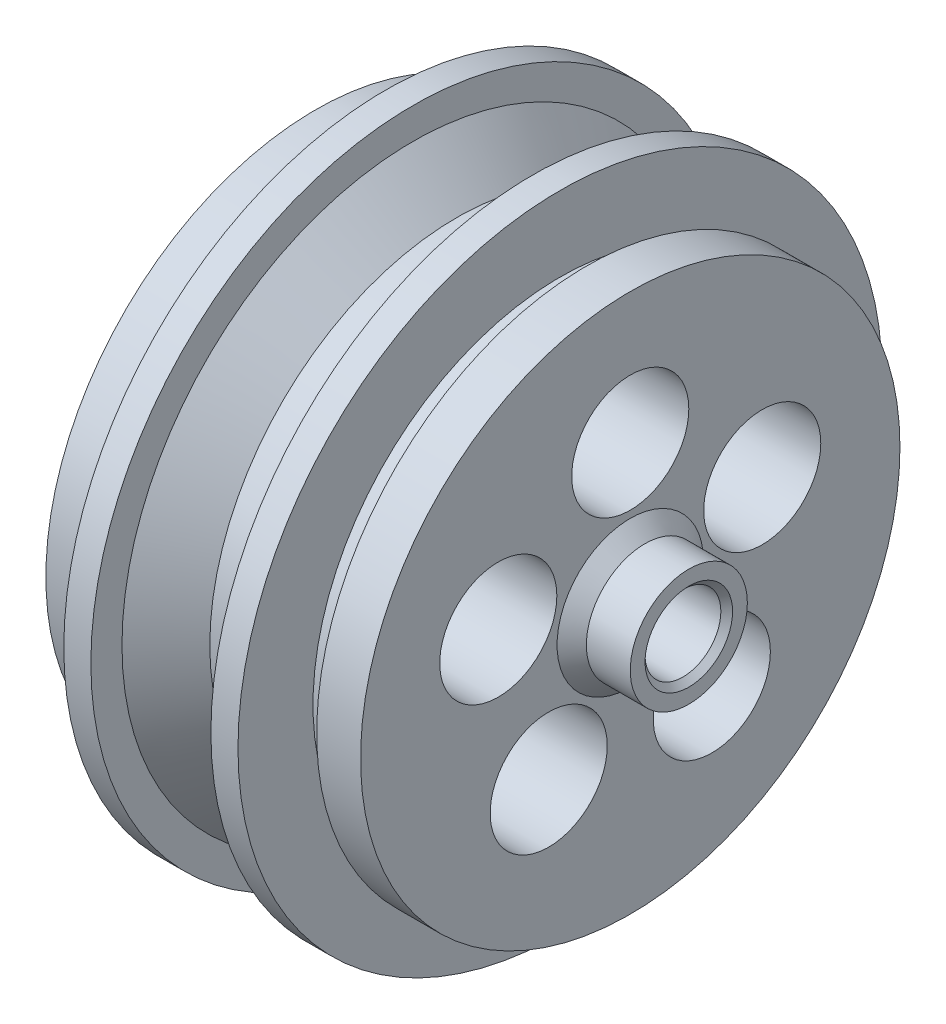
SolidWorks part; units mm, degrees
ref_plane "Front Plane" through (0, 0, 0) normal (0, 0, 1) x (1, 0, 0)
ref_plane "Top Plane" through (0, 0, 0) normal (0, 1, 0) x (1, 0, 0)
ref_plane "Right Plane" through (0, 0, 0) normal (1, 0, 0) x (0, 0, -1)
sketch "Sketch1" plane through (0, 0, 0) normal (1, 0, 0) x (0, 0, -1)
  circle A0 centre (0, 0) radius 16.875
  dimension "D1" = 33.75
extrude "Boss-Extrude1" add sketch "Sketch1" along normal blind 8.2
sketch "Sketch2" plane through (8.2, 0, 0) normal (1, 0, 0) x (0, 0, -1)
  circle A0 centre (0, 0) radius 22
  dimension "D1" = 44
extrude "Boss-Extrude2" add sketch "Sketch2" along normal blind 1.85
sketch "Sketch3" plane through (10.05, 0, 0) normal (1, 0, 0) x (0, 0, -1)
  circle A0 centre (0, 0) radius 16.875
  dimension "D1" = 33.75
extrude "Boss-Extrude3" add sketch "Sketch3" along normal blind 1.8
sketch "Sketch4" plane through (11.85, 0, 0) normal (1, 0, 0) x (0, 0, -1)
  circle A0 centre (0, 0) radius 18.425
  dimension "D1" = 36.85
extrude "Boss-Extrude4" add sketch "Sketch4" along normal blind 3
ref_plane "Plane1" through (4.1, 0, 0) normal (-1, 0, 0) x (0, 0, 1)
mirror "Mirror1" about plane through (4.1, 0, 0) normal (-1, 0, 0) of "Boss-Extrude3", "Boss-Extrude4", "Boss-Extrude2"
sketch "Sketch5" plane through (14.85, 0, 0) normal (1, 0, 0) x (0, 0, -1)
  circle A0 centre (0, 0) radius 2.59
  dimension "D1" = 5.18
extrude "Cut-Extrude1" cut sketch "Sketch5" against normal through all both and the other way through all
sketch "Sketch6" plane through (14.85, 0, 0) normal (1, 0, 0) x (0, 0, -1)
  line L0 (0, 0) -> (0, 9.4798) construction
  circle A0 centre (0, 9.4798) radius 4
  dimension "D1" = 8
extrude "Cut-Extrude2" cut sketch "Sketch6" against normal through all both and the other way through all
pattern_circular "CirPattern1" count 5 over 360 about axis through (0, 0, 0) along (1, 0, 0) of "Cut-Extrude2"
chamfer "Chamfer1" distance 3 angle 45 2 edges at (8.2, 0, -16.875) (0, 0, -16.875)
sketch "Sketch7" plane through (14.85, 0, 0) normal (1, 0, 0) x (0, 0, -1)
  circle A0 centre (0, 0) radius 4
  circle A1 centre (0, 0) radius 2.59 construction
  circle A2 centre (0, 0) radius 2.59
  dimension "D1" = 8
extrude "Boss-Extrude5" add sketch "Sketch7" along normal blind 4
chamfer "Chamfer2" distance 1 angle 45 1 edges at (14.85, 0, -4)
chamfer "Chamfer3" distance 0.4 angle 45 1 edges at (18.85, 0, -2.59)
sketch "Sketch9" plane through (0, 0, 0) normal (0, 0, 1) x (1, 0, 0)
  line L0 (0, 0) -> (6.9385, 0) construction
  line L1 (-6.65, 31) -> (14.85, 31)
  line L2 (-6.65, 31) -> (-6.65, 22)
  line L3 (-6.65, 22) -> (14.85, 22)
  line L4 (14.85, 31) -> (14.85, 22)
  line L5 (0, 22) -> (-1.85, 22) construction
  line L6 (-6.65, 18.425) -> (-6.65, -18.425) construction
  line L7 (14.85, -18.425) -> (14.85, 18.425) construction
  dimension "D1" = 62
